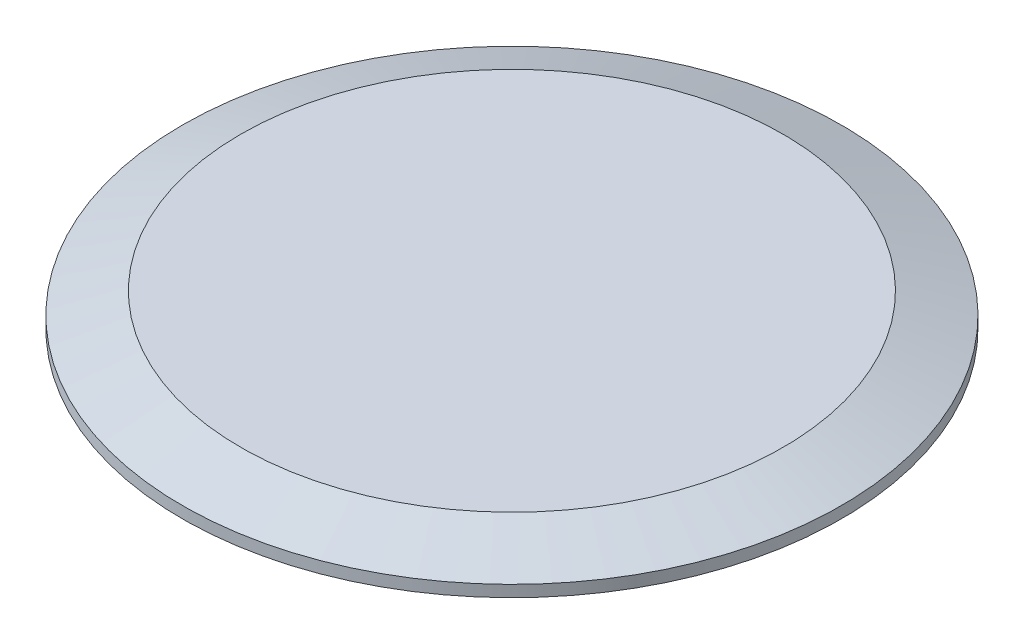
SolidWorks part; units mm, degrees
ref_plane "Front Plane" through (0, 0, 0) normal (0, 0, 1) x (1, 0, 0)
ref_plane "Top Plane" through (0, 0, 0) normal (0, 1, 0) x (1, 0, 0)
ref_plane "Right Plane" through (0, 0, 0) normal (1, 0, 0) x (0, 0, -1)
sketch "Sketch1" plane through (0, 0, 0) normal (0, 0, 1) x (1, 0, 0)
  line L0 (0, 0) -> (-152.5632, 0)
  line L1 (-159.639, 0) -> (-159.639, 5.588)
  line L2 (-159.639, 5.588) -> (-131.3757, 15.875)
  line L3 (-131.3757, 15.875) -> (0, 15.875)
  line L4 (0, 15.875) -> (0, 0) construction
  line L5 (-156.1992, 0) -> (-159.639, 0)
  line L6 (0, 0) -> (0, 15.875)
  arc A0 (-153.2857, 0.4745) -> (-155.4767, 0.4745) centre (-154.3812, 0) ccw
  arc A1 (-152.5632, 0) -> (-153.2857, 0.4745) centre (-152.5632, 0.7874) cw
  arc A2 (-156.1992, 0) -> (-155.4767, 0.4745) centre (-156.1992, 0.7874) ccw
  point P13 (-155.575, 0)
  dimension "D1" = 2.3876
  dimension "D2" = 0.7874
  dimension "D3" = 159.639
  dimension "D4" = 154.3812
  dimension "D5" = 5.588
  dimension "D6" = 20
  dimension "D7" = 15.875
revolve "Revolve1" add sketch "Sketch1" angle 360 about L4
